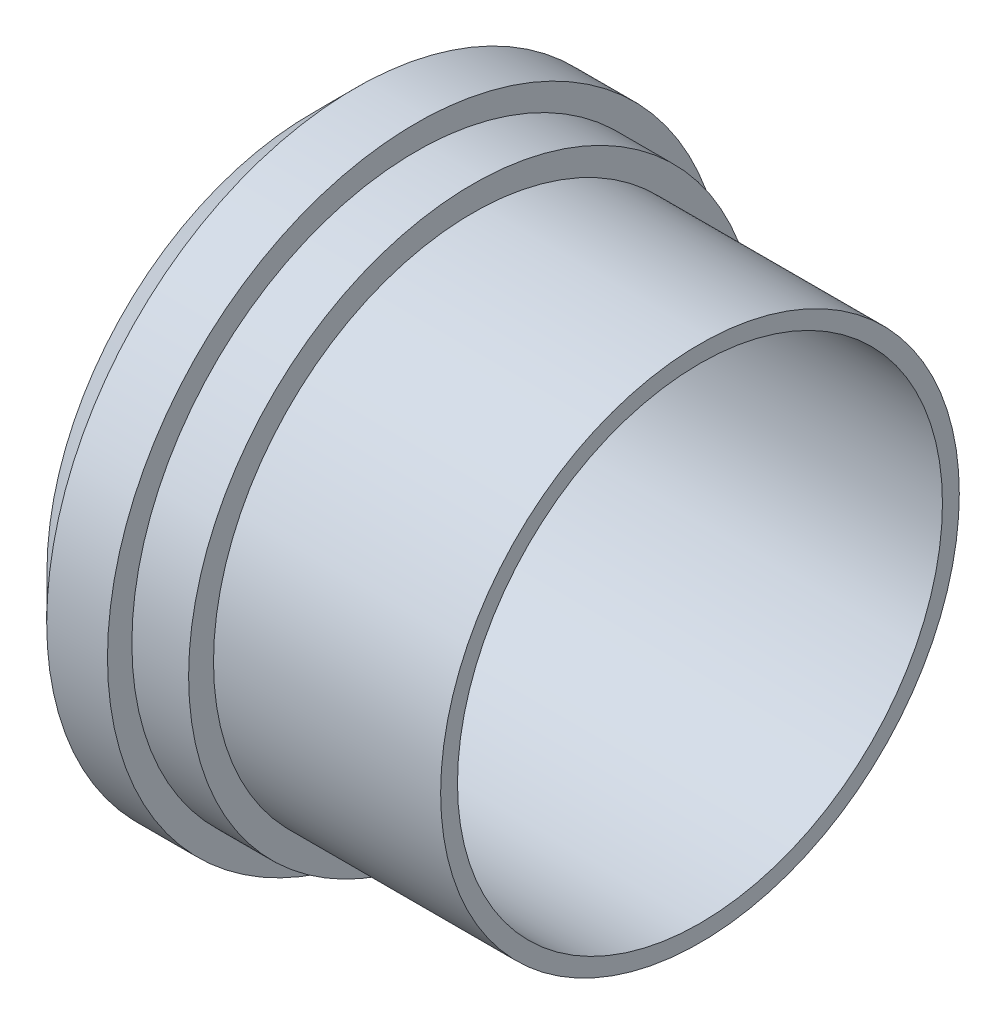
SolidWorks part; units mm, degrees
ref_plane "Front Plane" through (0, 0, 0) normal (0, 0, 1) x (1, 0, 0)
ref_plane "Top Plane" through (0, 0, 0) normal (0, 1, 0) x (1, 0, 0)
ref_plane "Right Plane" through (0, 0, 0) normal (1, 0, 0) x (0, 0, -1)
sketch "Sketch1" plane through (0, 0, 0) normal (0, 0, 1) x (1, 0, 0)
  line L0 (0, 0) -> (-22.2453, 0)
  line L1 (-22.2453, 0) -> (-22.2453, -2.4384)
  line L2 (-22.2453, -2.4384) -> (-27.8028, -2.4384)
  line L3 (-27.8028, -2.4384) -> (-27.8028, -4.826)
  line L4 (-27.8028, -4.826) -> (-33.7566, -4.826)
  line L5 (-33.7566, -4.826) -> (-38.1, -0.4572)
  line L6 (-38.1, -0.4572) -> (-38.1, 25.4)
  line L7 (-38.1, 25.4) -> (0, 25.4)
  line L8 (0, 25.4) -> (0, 0)
  dimension "D1" = 25.4
  dimension "D2" = 38.1
  dimension "D3" = 5.5575
  dimension "D4" = 5.9538
  dimension "D5" = 4.3434
  dimension "D6" = 25.8572
  dimension "D7" = 30.226
  dimension "D8" = 27.8384
revolve "Revolve1" add sketch "Sketch1" angle 360 about L7
sketch "Sketch4" plane through (-38.1, 0, 0) normal (-1, 0, 0) x (0, 0, 1)
  circle A0 centre (0, 25.4) radius 23.749
extrude "Cut-Extrude1" cut sketch "Sketch4" against normal blind 38.1 contours A0
